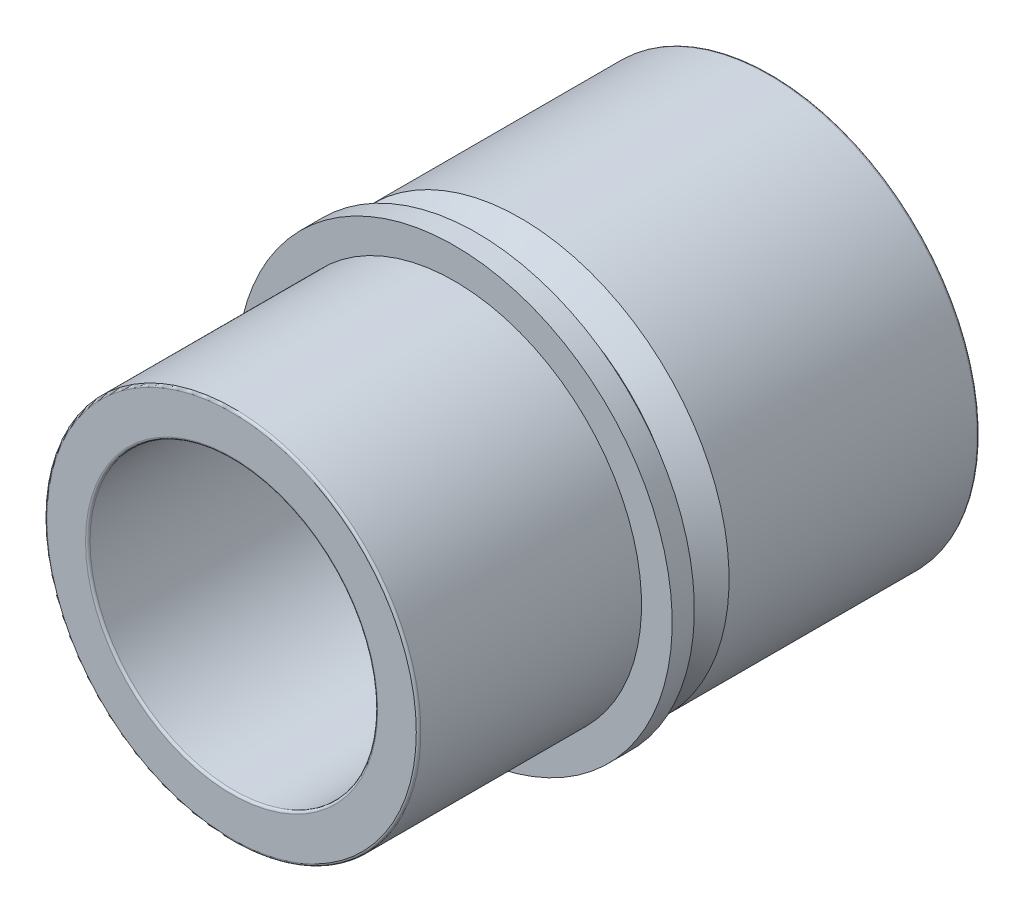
SolidWorks part; units mm, degrees
ref_plane "Front" through (0, 0, 0) normal (0, 0, 1) x (1, 0, 0)
ref_plane "Top" through (0, 0, 0) normal (0, 1, 0) x (1, 0, 0)
ref_plane "Right" through (0, 0, 0) normal (1, 0, 0) x (0, 0, -1)
sketch "Logo3_Revol_Axis" plane through (0, 0, 0) normal (0, 1, 0) x (1, 0, 0)
  line L0 (0, -30.1653) -> (0, 30.1653) construction
sketch "Logo3_bib1" plane through (0, 0, 0) normal (0, -1, 0) x (-1, 0, 0)
  line L0 (31.75, 69.342) -> (31.75, -48.7045)
  line L1 (32.258, -49.2125) -> (40.767, -49.2125)
  line L2 (41.275, -48.7045) -> (41.275, 0)
  line L3 (41.275, 0) -> (48.0441, 0)
  line L4 (48.0441, 0) -> (48.0441, 4.9022)
  line L5 (48.0441, 4.9022) -> (41.275, 4.9022)
  line L6 (46.0375, 14.5669) -> (46.0375, 69.342)
  line L7 (-25.4, 0) -> (25.4, 0) construction
  line L8 (41.275, 4.9022) -> (41.275, 9.8044)
  line L9 (45.5295, 69.85) -> (32.258, 69.85)
  line L10 (0, 41.5372) -> (0, -40.1764) construction
  line L11 (41.275, 9.8044) -> (48.0441, 9.8044) construction
  line L12 (41.275, 4.9022) -> (0, 4.9022) construction
  line L13 (41.275, 9.8044) -> (46.0375, 14.5669)
  arc A0 (46.0375, 69.342) -> (45.5295, 69.85) centre (45.5295, 69.342) ccw
  arc A1 (31.75, 69.342) -> (32.258, 69.85) centre (32.258, 69.342) cw
  arc A2 (41.275, -48.7045) -> (40.767, -49.2125) centre (40.767, -48.7045) cw
  arc A3 (32.258, -49.2125) -> (31.75, -48.7045) centre (32.258, -48.7045) cw
  point P24 (48.0441, 4.9022)
  dimension "D1" = 45
  dimension "D2" = 0.508
  dimension "logo3_d1" = 50.8
  dimension "logo3_l1" = 49.2125
  dimension "logo3_d5" = 63.5
  dimension "logo3_d2" = 82.55
  dimension "logo3_d3" = 92.075
  dimension "logo3_d4" = 96.0882
  dimension "logo3_l2" = 69.85
  dimension "logo3_l3" = 4.9022
revolve "Revolve1" add sketch "Logo3_bib1" angle 360 about L10
